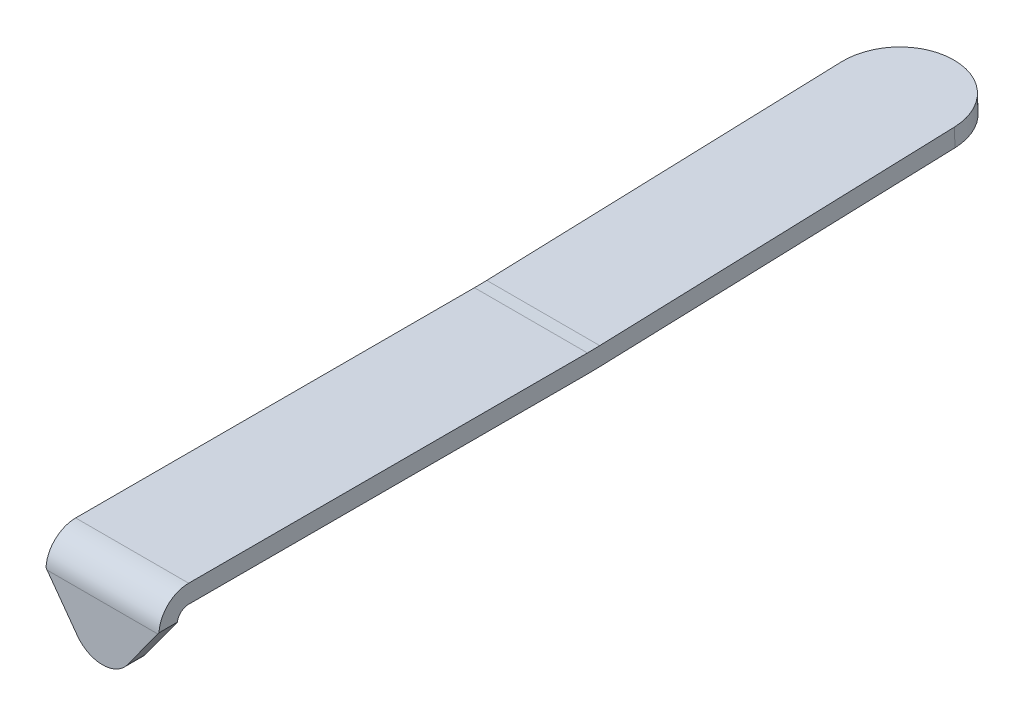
SolidWorks part; units mm, degrees
ref_plane "Спереди" through (0, 0, 0) normal (0, 0, 1) x (1, 0, 0)
ref_plane "Сверху" through (0, 0, 0) normal (0, 1, 0) x (1, 0, 0)
ref_plane "Справа" through (0, 0, 0) normal (1, 0, 0) x (0, 0, -1)
sketch "Эскиз1" plane through (0, 0, 0) normal (-1, 0, 0) x (0, 1, 0)
  line L0 (0, 0) -> (0, 103.7821) construction
  line L1 (0, 0) -> (0, 29.7656)
  line L2 (0.0151, 30.6624) -> (0.9746, 59.182)
  line L3 (0.9746, 59.182) -> (2.2439, 59.1393)
  line L4 (2.2439, 59.1393) -> (1.2844, 30.6197)
  line L5 (1.27, 29.7656) -> (1.27, 0)
  line L6 (1.27, 0) -> (0, 0)
  arc A0 (1.2844, 30.6197) -> (1.27, 29.7656) centre (26.67, 29.7656) ccw
  arc A1 (0, 29.7656) -> (0.0151, 30.6624) centre (26.67, 29.7656) cw
  point P13 (0, 30.2142)
  dimension "D2" = 1.016
  dimension "D5" = 25.4
  dimension "D6" = 26.67
  dimension "D1" = 59.182
  dimension "D3" = 1.27
  dimension "D4" = 1.27
  dimension "D7" = 29.7656
extrude "Бобышка-Вытянуть3" add sketch "Эскиз1" along normal mid plane 7.8486
sketch "Эскиз2" plane through (0, 0, 0) normal (0, 0, 1) x (1, 0, 0)
  line L0 (0, 0) -> (0, -4.572) construction
  line L1 (-1.7467, -3.682) -> (-3.9243, -0.6848)
  line L2 (-3.9243, -0.6848) -> (-3.9243, 1.27)
  line L3 (-3.9243, 1.27) -> (3.9243, 1.27)
  line L4 (3.9243, 1.27) -> (3.9243, -0.6848)
  line L5 (3.9243, -0.6848) -> (1.7467, -3.682)
  line L7 (-3.9243, 1.27) -> (3.9243, 1.27) construction
  line L8 (-3.9243, 0) -> (-3.9243, 1.27) construction
  line L9 (3.9243, 0) -> (3.9243, 1.27) construction
  arc A0 (1.7467, -3.682) -> (-1.7467, -3.682) centre (0, -2.413) cw
  dimension "D1" = 2.159
  dimension "D2" = 36
  dimension "D3" = 5.842
extrude "Бобышка-Вытянуть2" add sketch "Эскиз2" against normal blind 1.27
fillet "Скругление1" radius 0.7937 1 edges at (0, 0, -1.27)
fillet "Скругление3" radius 2.0638 1 edges at (0, 1.27, 0)
fillet "Скругление4" radius 3.8862 2 edges at (3.9243, 1.6093, -59.1606) (-3.9243, 1.6093, -59.1606)
